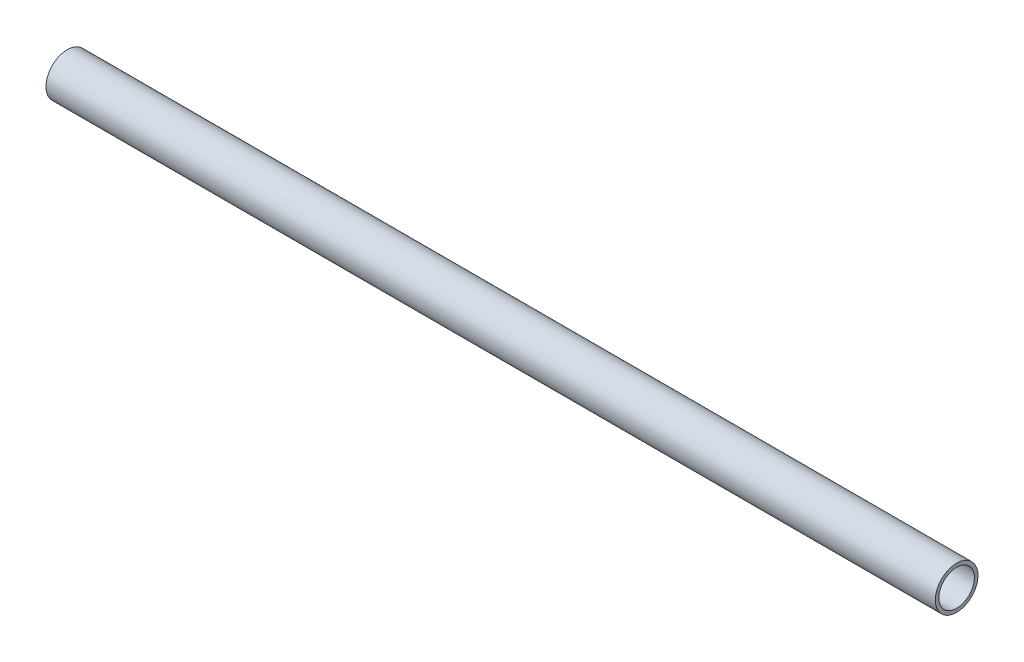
SolidWorks part; units mm, degrees
ref_plane "Front Plane" through (0, 0, 0) normal (0, 0, 1) x (1, 0, 0)
ref_plane "Top Plane" through (0, 0, 0) normal (0, 1, 0) x (1, 0, 0)
ref_plane "Right Plane" through (0, 0, 0) normal (1, 0, 0) x (0, 0, -1)
sketch "Sketch1" plane through (0, 0, 0) normal (1, 0, 0) x (0, 0, -1)
  circle A0 centre (0, 0) radius 100
  circle A1 centre (0, 0) radius 120
extrude "Extrude1" add sketch "Sketch1" along normal blind 5000
sketch "x = 0, D, 2D, 3D, 4D, 23D" plane through (0, 0, 0) normal (0, 0, 1) x (1, 0, 0)
  line L0 (0, 0) -> (0, 100)
  line L1 (200, 0) -> (200, 100)
  line L2 (5000, 100) -> (0, 100) construction
  line L3 (400, 0) -> (400, 100)
  line L4 (600, 0) -> (600, 100)
  line L5 (800, 0) -> (800, 100)
  line L6 (4600, 0) -> (4600, 100)
sketch "x = 0 - 4.6 m (centerline)" plane through (0, 0, 0) normal (0, 0, 1) x (1, 0, 0)
  line L0 (0, 0) -> (4600, 0)
sketch "x = 0 - 4.6 m (wall)" plane through (0, 0, 0) normal (0, 0, 1) x (1, 0, 0)
  line L0 (0, 100) -> (4600, 100)
  line L1 (5000, 100) -> (0, 100) construction
